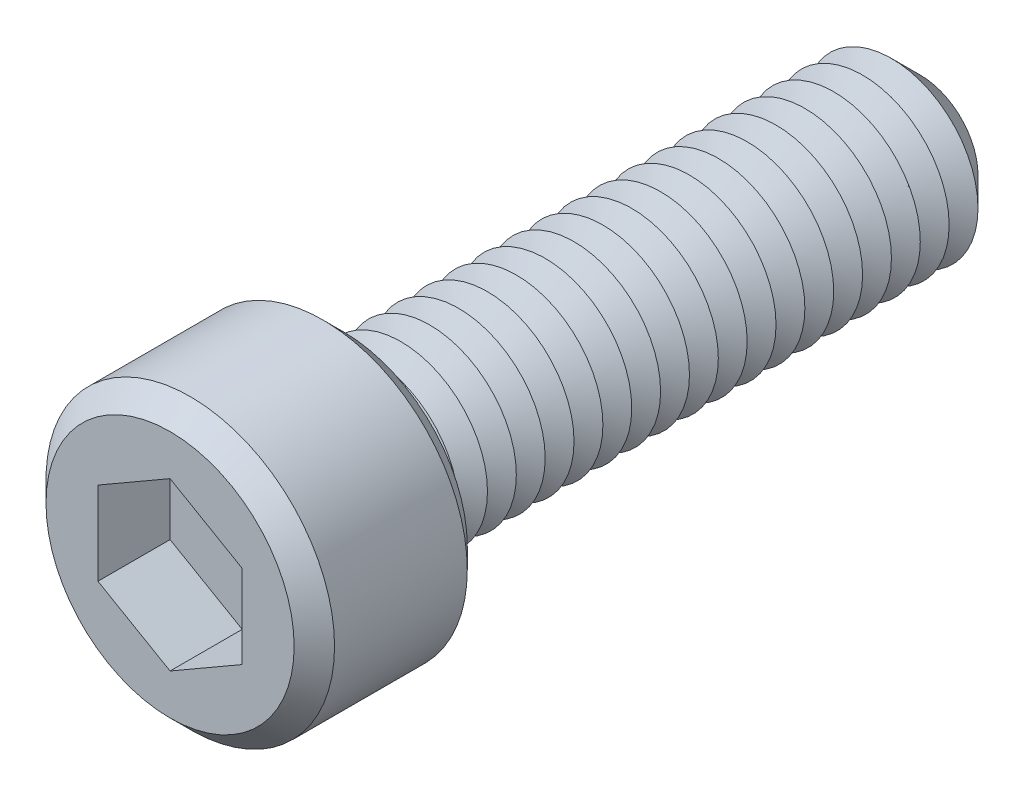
SolidWorks part; units mm, degrees
ref_plane "Front Plane" through (0, 0, 0) normal (0, 0, 1) x (1, 0, 0)
ref_plane "Top Plane" through (0, 0, 0) normal (0, 1, 0) x (1, 0, 0)
ref_plane "Right Plane" through (0, 0, 0) normal (1, 0, 0) x (0, 0, -1)
sketch "Sketch1" plane through (0, 0, 0) normal (0, 0, 1) x (1, 0, 0)
  circle A0 centre (0, 0) radius 5
  dimension "D1" = 10
extrude "Boss-Extrude1" add sketch "Sketch1" along normal blind 6
sketch "Sketch2" plane through (0, 0, 0) normal (0, 0, -1) x (-1, 0, 0)
  circle A0 centre (0, 0) radius 3
  dimension "D1" = 6
extrude "Boss-Extrude2" add sketch "Sketch2" along normal blind 20
chamfer "Chamfer1" distance 1 angle 45 1 edges at (-3, 0, -20)
sketch "Sketch3" plane through (0, 0, 0) normal (1, 0, 0) x (0, 0, -1)
  line L0 (-2.5121, 0) -> (4.5776, 0) construction
sketch "Sketch4" plane through (0, 0, 0) normal (1, 0, 0) x (0, 0, -1)
  line L0 (0, 3) -> (0.5, 2.134)
  line L1 (0.5, 2.134) -> (1, 3)
  line L2 (19, 3) -> (0, 3) construction
  line L3 (1, 3) -> (0, 3)
  dimension "D1" = 1
revolve "Cut-Revolve1" cut sketch "Sketch4" angle 360 about L0
pattern_linear "LPattern1" count 19 spacing 1 along (0, 0, -1) of "Cut-Revolve1"
sketch "Sketch5" plane through (0, 0, 6) normal (0, 0, 1) x (1, 0, 0)
  line L1 (0, 2.8868) -> (-2.5, 1.4434)
  line L2 (-2.5, 1.4434) -> (-2.5, -1.4434)
  line L3 (-2.5, -1.4434) -> (0, -2.8868)
  line L4 (0, -2.8868) -> (2.5, -1.4434)
  line L5 (2.5, -1.4434) -> (2.5, 1.4434)
  line L6 (2.5, 1.4434) -> (0, 2.8868)
  circle A0 centre (0, 0) radius 2.5 construction
  dimension "D1" = 5
extrude "Cut-Extrude1" cut sketch "Sketch5" against normal blind 2.5
sketch "Sketch6" plane through (0, 0, 3.5) normal (0, 0, 1) x (1, 0, 0)
  circle A0 centre (0, 0) radius 0.8
  dimension "D1" = 1.6
extrude "Cut-Extrude2" cut sketch "Sketch6" against normal up to surface (23.5 mm away)
chamfer "Chamfer2" distance 0.7 angle 45 2 edges at (5, 0, 0) (5, 0, 6)
